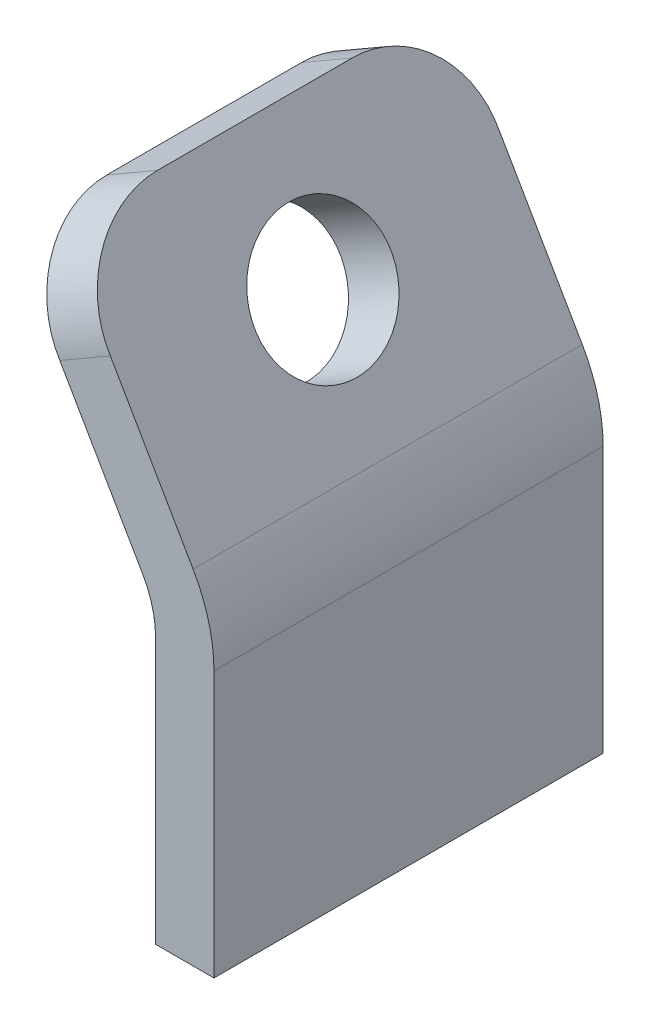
SolidWorks part; units mm, degrees
ref_plane "Plan1" through (0, 0, 0) normal (0, 0, 1) x (1, 0, 0)
ref_plane "Plan2" through (0, 0, 0) normal (0, 1, 0) x (1, 0, 0)
ref_plane "Plan3" through (0, 0, 0) normal (1, 0, 0) x (0, 0, -1)
sketch "Esquisse1" plane through (0, 0, 0) normal (0, 0, 1) x (1, 0, 0)
  line L0 (-6.0981, 4.5622) -> (0.7321, -7.2679)
  line L1 (1.4019, -9.7679) -> (1.4019, -23.4282)
  line L2 (1.4019, -23.4282) -> (4.4019, -23.4282)
  line L3 (4.4019, -23.4282) -> (4.4019, -9.7679)
  line L4 (3.3301, -5.7679) -> (-3.5, 6.0622)
  line L5 (-3.5, 6.0622) -> (-6.0981, 4.5622)
  arc A0 (1.4019, -9.7679) -> (0.7321, -7.2679) centre (-3.5981, -9.7679) ccw
  arc A1 (4.4019, -9.7679) -> (3.3301, -5.7679) centre (-3.5981, -9.7679) ccw
  point P11 (1.4019, -8.4282)
  dimension "D6" = 5
  dimension "D7" = 8
  dimension "D1" = 3
  dimension "D2" = 3
  dimension "D3" = 150
  dimension "D4" = 15
  dimension "D5" = 15
  dimension "D8" = 7
extrude "Base-Extrusion" add sketch "Esquisse1" along normal mid plane 20
sketch "Esquisse2" plane through (0, 0, 0) normal (0.866, 0.5, 0) x (0, 0, -1)
  line L1 (-10, -6.6603) -> (-10, 7) construction
  line L2 (-10, 7) -> (10, 7) construction
  line L3 (10, -6.6603) -> (10, 7) construction
  circle A0 centre (0, 0) radius 3.5
  arc A1 (-5, 7) -> (-9.9971, 1.8302) centre (-5, 2) ccw
  arc A2 (9.9971, 1.8302) -> (5, 7) centre (5, 2) ccw
  spline_without_curve S0
  spline_without_curve S1
  dimension "D1" = 7
  dimension "D2" = 10
extrude "Enlèv. mat.-Extru.1" cut sketch "Esquisse2" against normal through all
